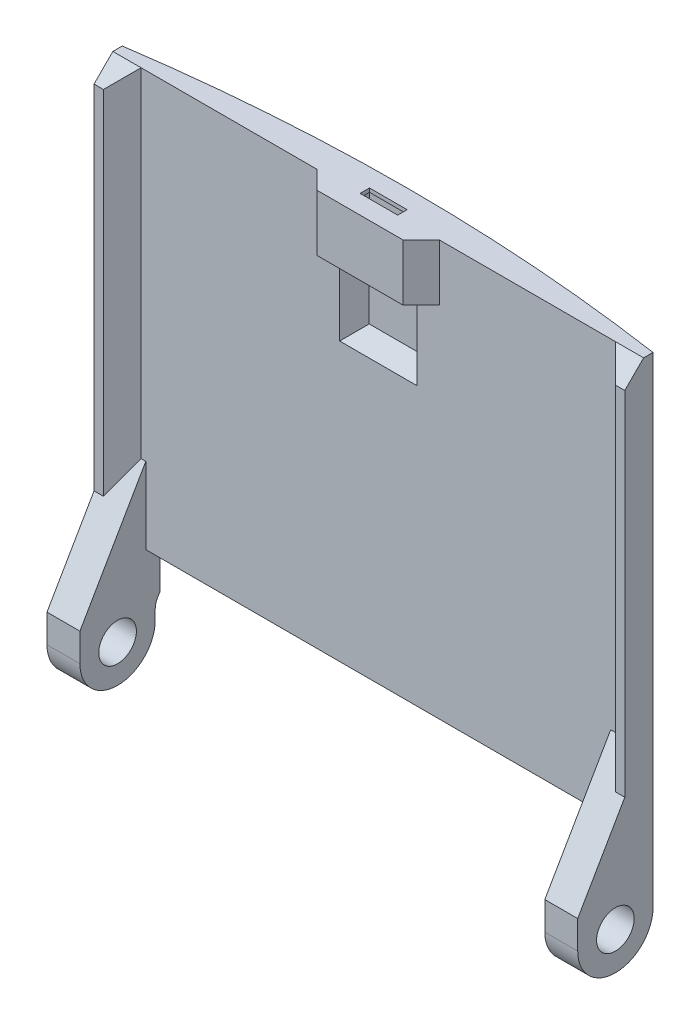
SolidWorks part; units mm, degrees
ref_plane "Front Plane" through (0, 0, 0) normal (0, 0, 1) x (1, 0, 0)
ref_plane "Top Plane" through (0, 0, 0) normal (0, 1, 0) x (1, 0, 0)
ref_plane "Right Plane" through (0, 0, 0) normal (1, 0, 0) x (0, 0, -1)
sketch "Sketch1" plane through (0, 0, 0) normal (0, 1, 0) x (1, 0, 0)
  line L0 (0, 0) -> (0, 193) construction
  line L1 (-28.2, 190.9287) -> (-28.2, 188.9287)
  line L2 (-28.2, 188.9287) -> (28.2, 188.9287)
  line L3 (28.2, 188.9287) -> (28.2, 190.9287)
  arc A0 (-28.2, 190.9287) -> (28.2, 190.9287) centre (0, 0) cw
  point P4 (0, 193)
  dimension "D1" = 193
  dimension "D2" = 56.4
  dimension "D3" = 2
extrude "Boss-Extrude1" add sketch "Sketch1" along normal blind 48.1
sketch "Sketch2" plane through (28.2, 0, 0) normal (1, 0, 0) x (0, 0, -1)
  line L0 (190.9287, 0) -> (193, 0) construction
  line L1 (190.9287, 0) -> (182.9287, 0)
  line L2 (190.9287, 0) -> (190.9287, -3)
  line L3 (190.9287, -3) -> (182.9287, -3) construction
  line L4 (182.9287, 0) -> (182.9287, -3)
  arc A0 (182.9287, -3) -> (190.9287, -3) centre (186.9287, -3) ccw
  circle A1 centre (186.9287, -3) radius 2
  dimension "D1" = 4
  dimension "D2" = 2
  dimension "D3" = 3
extrude "Boss-Extrude2" add sketch "Sketch2" against normal blind 3.5
chamfer "Chamfer1" distance 7 angle 60 1 edges at (26.45, 0, -189.9287)
mirror "Mirror1" about plane through (0, 0, 0) normal (1, 0, 0) of "Chamfer1", "Boss-Extrude2"
sketch "Sketch3" plane through (28.2, 0, 0) normal (1, 0, 0) x (0, 0, -1)
  line L0 (189.9287, 12.1244) -> (182.9287, 0) construction
  line L2 (190.9287, 48.1) -> (190.9287, 8.6603)
  line L3 (190.9287, 8.6603) -> (187.9287, 8.6603)
  line L4 (187.9287, 46.1) -> (187.9287, 8.6603)
  line L5 (190.9287, 48.1) -> (189.9287, 48.1)
  line L6 (189.9287, 48.1) -> (187.9287, 46.1)
  line L7 (189.9287, 48.1) -> (189.9287, 12.1244) construction
  dimension "D1" = 135
  dimension "D2" = 2
extrude "Boss-Extrude3" add sketch "Sketch3" against normal blind 1
mirror "Mirror2" about plane through (0, 0, 0) normal (1, 0, 0) of "Boss-Extrude3"
chamfer "Chamfer2" distance 2 angle 45 2 edges at (-27.2, 30.1122, -189.9287) (27.2, 30.1122, -189.9287)
sketch "Sketch4" plane through (0, 0, -189.9287) normal (0, 0, 1) x (1, 0, 0)
  line L0 (24.7, 0) -> (24.7, 12.1244) construction
  line L1 (-24.7, 0) -> (24.7, 0)
  line L2 (-24.7, 0) -> (-24.7, 2.5)
  line L3 (-24.7, 2.5) -> (24.7, 2.5)
  line L4 (24.7, 0) -> (24.7, 2.5)
  dimension "D1" = 2.5
extrude "Little bit of space" cut sketch "Sketch4" against normal through all
chamfer "Chamfer3" distance 1.5 angle 45 1 edges at (0, 2.5, -189.9287)
fillet "Fillet1" radius 2 2 edges at (-26.45, 0, -190.9287) (26.45, 0, -190.9287)
sketch "Sketch5" plane through (0, 48.1, 0) normal (0, 1, 0) x (1, 0, 0)
  line L0 (-25.2, 189.9287) -> (25.2, 189.9287) construction
  line L1 (2.5, 191.5) -> (-2.5, 191.5) construction
  line L2 (2.5, 191.5) -> (2.5, 189.5) construction
  line L3 (2.5, 189.5) -> (-2.5, 189.5) construction
  line L4 (-2.5, 191.5) -> (-2.5, 189.5) construction
  line L5 (2.5, 191.5) -> (-2.5, 189.5) construction
  line L6 (2.5, 189.5) -> (-2.5, 191.5) construction
  line L8 (-4.5, 189.9287) -> (4.5, 189.9287)
  line L9 (-4.5, 189.9287) -> (-4.5, 188)
  line L10 (-4.5, 188) -> (4.5, 188)
  line L11 (4.5, 189.9287) -> (4.5, 188)
  arc A0 (28.2, 190.9287) -> (-28.2, 190.9287) centre (0, 0) ccw construction
  point P0 (0, 190.5)
  point P5 (0, 188)
  point P14 (0, 193)
  dimension "D1" = 5
  dimension "D2" = 2
  dimension "D3" = 1.5
  dimension "D4" = 1.5
  dimension "D5" = 2
extrude "Boss-Extrude4" add sketch "Sketch5" against normal blind 6
sketch "Sketch6" plane through (0, 48.1, 0) normal (0, 1, 0) x (1, 0, 0)
  line L1 (-2.5, 191.5) -> (2.5, 191.5)
  line L2 (-2.5, 191.5) -> (-2.5, 189.5)
  line L3 (-2.5, 189.5) -> (2.5, 189.5)
  line L4 (2.5, 191.5) -> (2.5, 189.5)
extrude "Cut-Extrude2" cut sketch "Sketch6" against normal offset from surface (13 mm away) 7
sketch "Sketch7" plane through (0, 48.1, 0) normal (0, 1, 0) x (1, 0, 0)
  line L0 (-2, 191) -> (2, 191)
  line L1 (-2.5, 191.5) -> (2.5, 191.5)
  line L2 (-2.5, 191.5) -> (-2.5, 189.5)
  line L3 (-2.5, 189.5) -> (2.5, 189.5)
  line L4 (2.5, 191.5) -> (2.5, 189.5)
  line L5 (2, 191) -> (2, 190)
  line L6 (-2, 190) -> (2, 190)
  line L7 (-2, 191) -> (-2, 190)
  dimension "D1" = 0.5
extrude "Boss-Extrude5" add sketch "Sketch7" against normal blind 0.4
sketch "Sketch9" plane through (0, 48.1, 0) normal (0, 1, 0) x (1, 0, 0)
  line L0 (-2.5, 192.9838) -> (-2.5, 191.3838)
  line L1 (-2.5, 191.3838) -> (2.5, 191.3838)
  line L2 (2.5, 191.3838) -> (2.5, 192.9838)
  arc A0 (28.2, 190.9287) -> (-28.2, 190.9287) centre (0, 0) ccw construction
  arc A1 (2.5, 192.9838) -> (-2.5, 192.9838) centre (0, 0) ccw
  point P8 (0, 191.3838)
  dimension "D1" = 5
  dimension "D2" = 1.6
extrude "Boss-Extrude7" add sketch "Sketch9" along normal blind 1.5
chamfer "Chamfer6" distance 1.5 angle 45 2 edges at (-2.5, 48.1, -192.1838) (2.5, 48.1, -192.1838)
chamfer "Chamfer7" distance 1.6 angle 45 3 edges at (-2.5, 38.6, -189.9287) (2.5, 38.6, -189.9287) (0, 35.1, -189.9287)
chamfer "Chamfer8" distance 2 angle 45 2 edges at (-4.5, 45.1, -189.9287) (4.5, 45.1, -189.9287)
sketch "Sketch10" plane through (0, 48.1, 0) normal (0, 1, 0) x (1, 0, 0)
  line L1 (-7.9553, 197.6701) -> (7.3163, 197.6701)
  line L2 (-7.9553, 197.6701) -> (-7.9553, 187.7957)
  line L3 (-7.9553, 187.7957) -> (7.3163, 187.7957)
  line L4 (7.3163, 197.6701) -> (7.3163, 187.7957)
extrude "Cut-Extrude3" cut sketch "Sketch10" along normal through all
